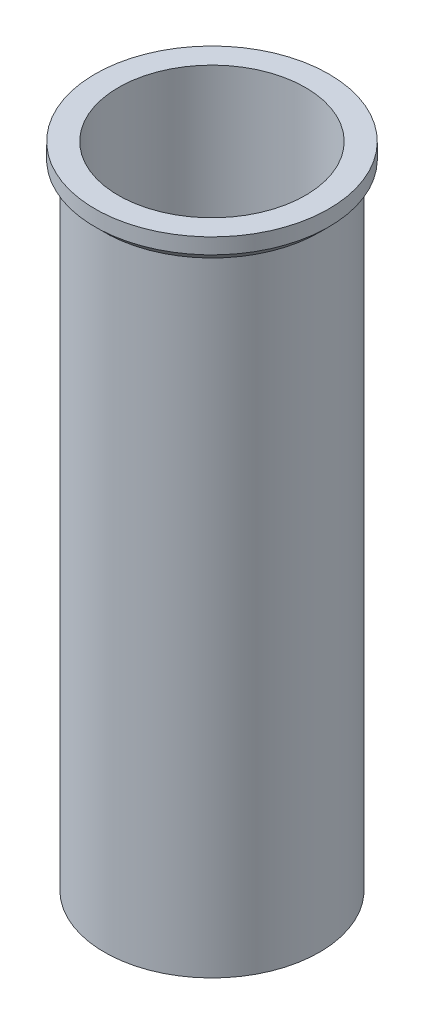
SolidWorks part; units mm, degrees
ref_plane "Plan de face" through (0, 0, 0) normal (0, 0, 1) x (1, 0, 0)
ref_plane "Plan de dessus" through (0, 0, 0) normal (0, 1, 0) x (1, 0, 0)
ref_plane "Plan de droite" through (0, 0, 0) normal (1, 0, 0) x (0, 0, -1)
sketch "Esquisse1" plane through (0, 0, 0) normal (0, 0, 1) x (1, 0, 0)
  line L0 (0, 0) -> (0, 19.8341) construction
  line L1 (0, 0) -> (-6.9, 0)
  line L2 (-6.9, 0) -> (-6.9, 40)
  line L3 (0, 0) -> (0, 1)
  line L4 (-7.5, 40.6) -> (-7.5, 41.6)
  line L5 (-7.5, 41.6) -> (-6, 41.6)
  line L6 (-6, 41.6) -> (-6, 1)
  line L7 (-6, 1) -> (0, 1)
  line L8 (-7.5, 40.6) -> (-6.9, 40)
  point P10 (-7.5, 41.1)
  dimension "D1" = 12
  dimension "D2" = 13.8
  dimension "D3" = 1
  dimension "D4" = 1
  dimension "D5" = 15
  dimension "D6" = 40
  dimension "D7" = 0.6
revolve "Révolution1" add sketch "Esquisse1" angle 360 about L0
